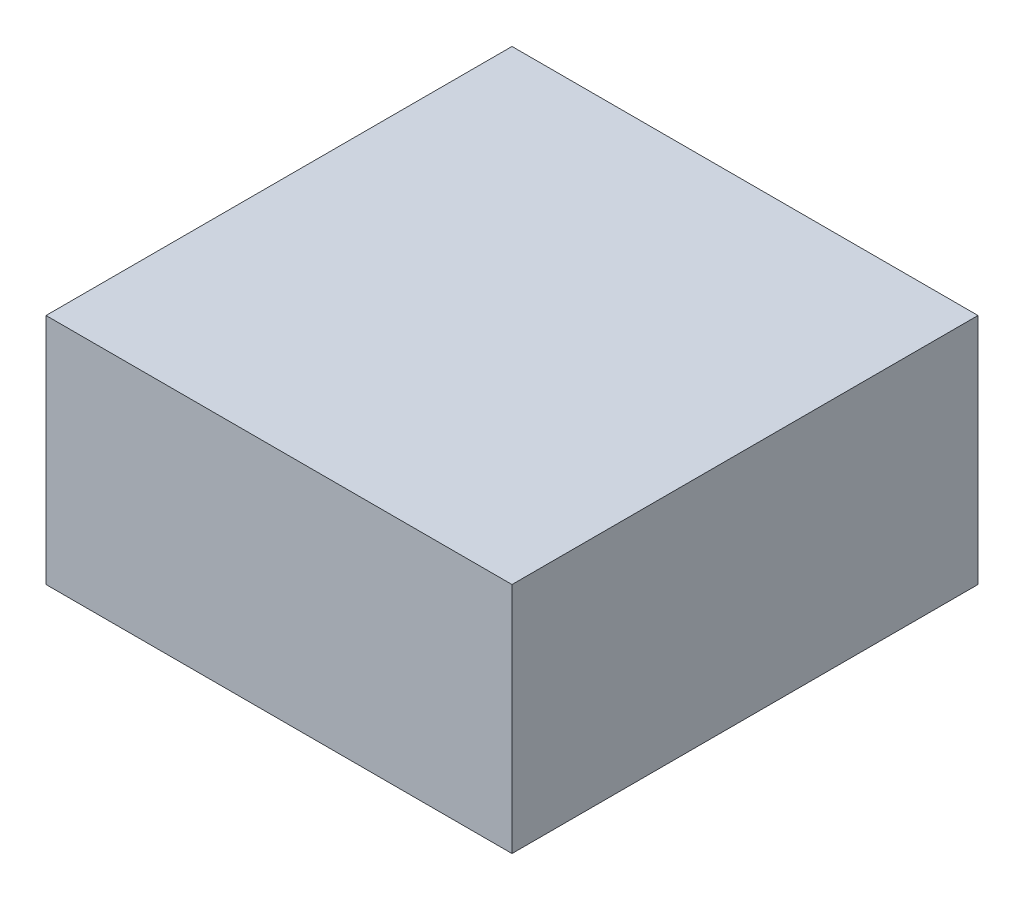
SolidWorks part; units mm, degrees
ref_plane "Ebene vorne" through (0, 0, 0) normal (0, 0, 1) x (1, 0, 0)
ref_plane "Ebene oben" through (0, 0, 0) normal (0, 1, 0) x (1, 0, 0)
ref_plane "Ebene rechts" through (0, 0, 0) normal (1, 0, 0) x (0, 0, -1)
sketch "Skizze1" plane through (0, 0, 0) normal (0, 1, 0) x (1, 0, 0)
  line L1 (-100, 0) -> (0, 0)
  line L2 (-100, 0) -> (-100, 100)
  line L3 (-100, 100) -> (0, 100)
  line L4 (0, 0) -> (0, 100)
  dimension "D1" = 100
  dimension "D2" = 100
extrude "Aufsatz-Linear austragen1" add sketch "Skizze1" along normal blind 50
